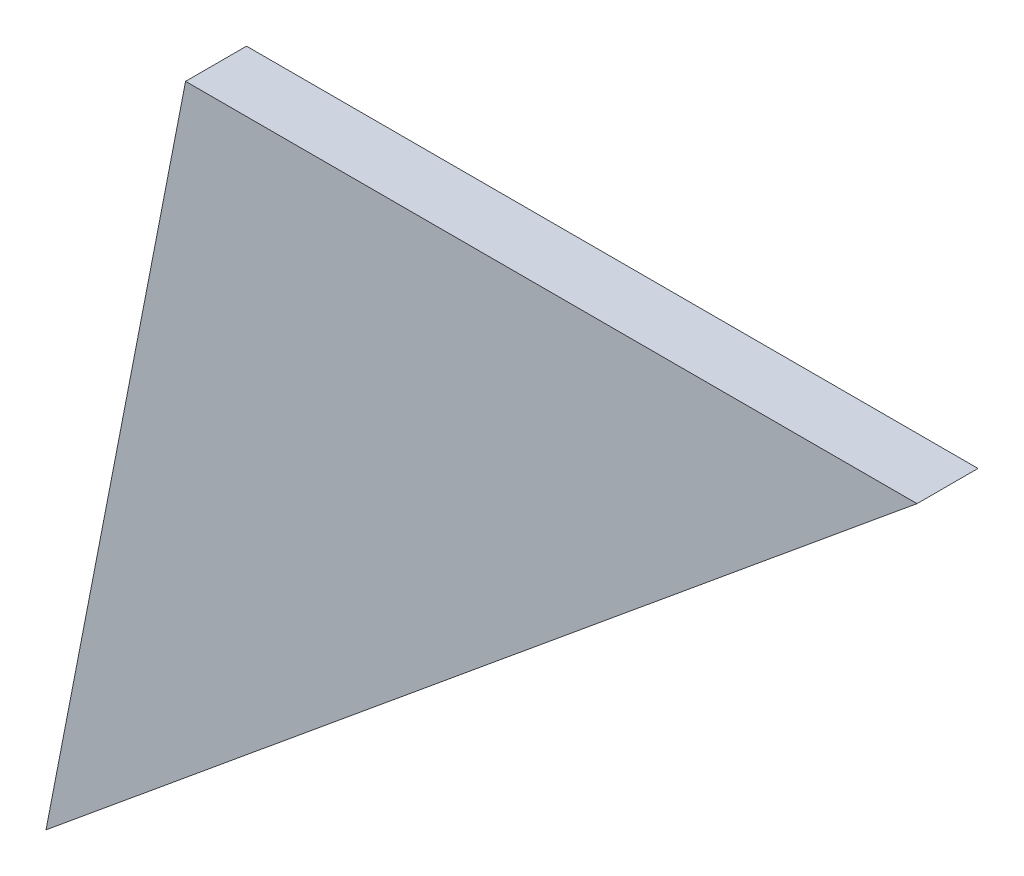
SolidWorks part; units mm, degrees
ref_plane "Front Plane" through (0, 0, 0) normal (0, 0, 1) x (1, 0, 0)
ref_plane "Top Plane" through (0, 0, 0) normal (0, 1, 0) x (1, 0, 0)
ref_plane "Right Plane" through (0, 0, 0) normal (1, 0, 0) x (0, 0, -1)
sketch "Sketch1" plane through (0, 0, 0) normal (0, 0, 1) x (1, 0, 0)
  line L0 (0, 0) -> (76.2, 0)
  line L1 (0, 0) -> (-14.5396, -74.8)
  line L2 (-14.5396, -74.8) -> (76.2, 0)
  dimension "D1" = 76.2
  dimension "D2" = 76.2
  dimension "D3" = 101
extrude "Extrude1" add sketch "Sketch1" along normal blind 6.35
